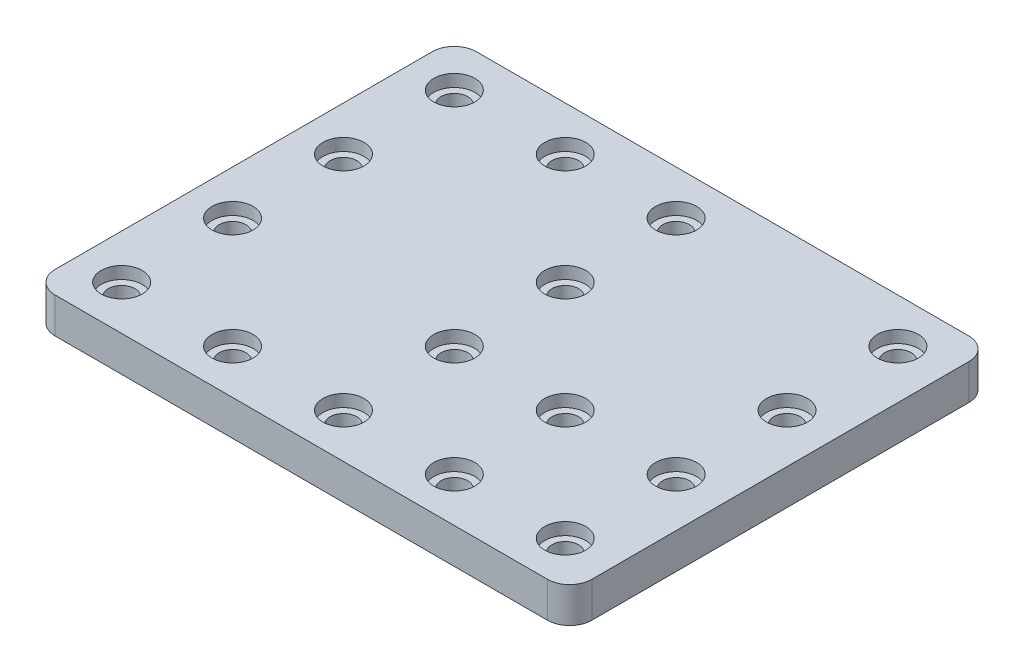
SolidWorks part; units mm, degrees
ref_plane "Front" through (0, 0, 0) normal (0, 0, 1) x (1, 0, 0)
ref_plane "Top" through (0, 0, 0) normal (0, 1, 0) x (1, 0, 0)
ref_plane "Right" through (0, 0, 0) normal (1, 0, 0) x (0, 0, -1)
sketch "Sketch1" plane through (0, 0, 0) normal (0, 1, 0) x (1, 0, 0)
  line L1 (10, 0) -> (232, 0)
  line L2 (0, 10) -> (0, 180)
  line L3 (10, 190) -> (232, 190)
  line L4 (242, 10) -> (242, 180)
  arc A0 (10, 0) -> (0, 10) centre (10, 10) cw
  arc A1 (10, 190) -> (0, 180) centre (10, 180) ccw
  arc A2 (242, 180) -> (232, 190) centre (232, 180) ccw
  arc A3 (232, 0) -> (242, 10) centre (232, 10) ccw
  point P6 (0, 0)
  point P9 (0, 190)
  point P12 (242, 190)
  point P15 (242, 0)
  dimension "D3" = 10
  dimension "D1" = 242
  dimension "D2" = 190
extrude "Extrude1" add sketch "Sketch1" along normal blind 16
hole_wizard "CBORE for M10 SBHCS1" positions "Sketch4" profile "Sketch3" counterbore size "M10" standard "Ansi Metric"
sketch "Sketch4" plane through (0, 16, 0) normal (0, 1, 0) x (-1, 0, 0)
  line L0 (0, -180) -> (0, -10) construction
  line L1 (-10, 0) -> (-232, 0) construction
  point P0 (-20, -20)
  dimension "D1" = 20
  dimension "D2" = 20
sketch "Sketch3" plane through (20, 16, -20) normal (1, 0, 0) x (0, 0, 1)
  line L0 (0, 0) -> (0, 16)
  line L1 (0, 16) -> (6, 16)
  line L3 (6, 16) -> (6, 5.5)
  line L4 (6, 5.5) -> (9.25, 5.5)
  line L5 (9.25, 5.5) -> (9.25, 0)
  line L7 (9.25, 0) -> (0, 0)
  line L11 (0, -6.35) -> (0, 107.95) construction
  dimension "Thru Hole Dia." = 12
  dimension "Thru Hole Depth" = 16
  dimension "C'Bore Dia." = 18.5
  dimension "C'Bore Depth" = 5.5
pattern_linear "LPattern2" count 4 spacing 50 along (0, 0, -1) count 5 spacing 50 along (1, 0, 0) of "CBORE for M10 SBHCS1"
